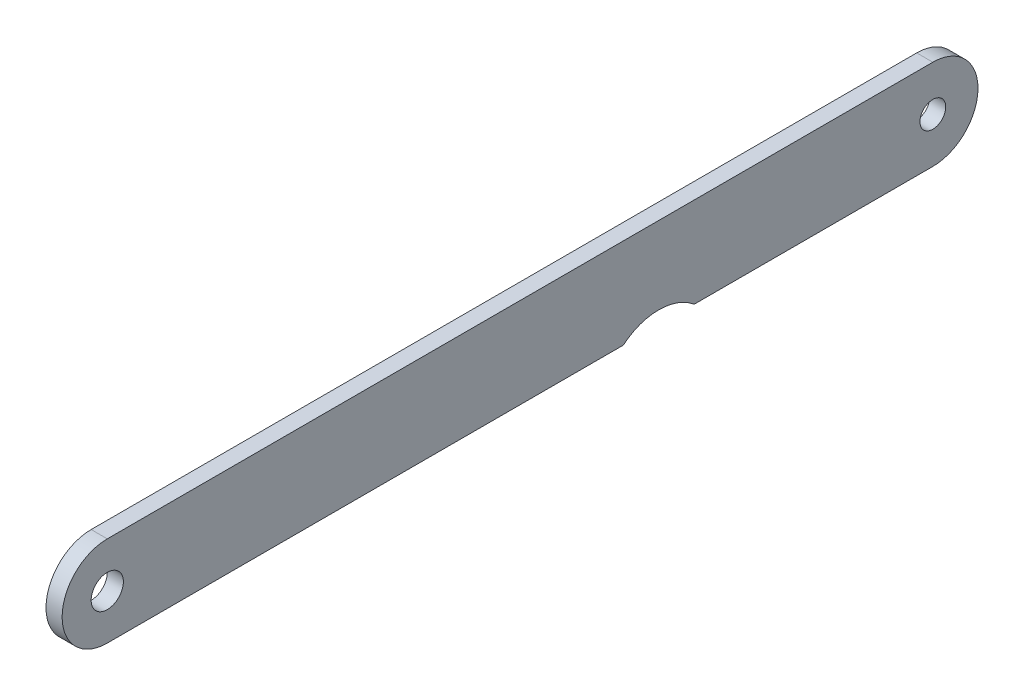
SolidWorks part; units mm, degrees
ref_plane "Front" through (0, 0, 0) normal (0, 0, 1) x (1, 0, 0)
ref_plane "Top" through (0, 0, 0) normal (0, 1, 0) x (1, 0, 0)
ref_plane "Right" through (0, 0, 0) normal (1, 0, 0) x (0, 0, -1)
sketch "Sketch1"
  dimension "D2" = 128
  dimension "D1" = 14
extrude "Extrude1" add sketch "Sketch1" along normal blind 2.5
sketch "Sketch2"
  dimension "D1" = 37
  dimension "D2" = 11
  dimension "D3" = 2
extrude "Cut-Extrude1" cut sketch "Sketch2" against normal up to next
sketch "Sketch3"
  dimension "D1" = 128
hole_wizard "M5.0 (5) Diameter Hole1" positions "3DSketch1" profile "Sketch4" hole size "M5.0" standard "Ansi Metric"
sketch3d "3DSketch1"
sketch "Sketch4"
  dimension "Thru Hole Dia." = 5
  dimension "Thru Hole Depth" = 2.5
hole_wizard "M4.0 (4) Diameter Hole1" positions "3DSketch2" profile "Sketch5" hole size "M4.0" standard "Ansi Metric"
sketch3d "3DSketch2"
sketch "Sketch5"
  dimension "Hole Dia." = 4
  dimension "Hole Depth" = 5
  dimension "Drill Angle" = 118
